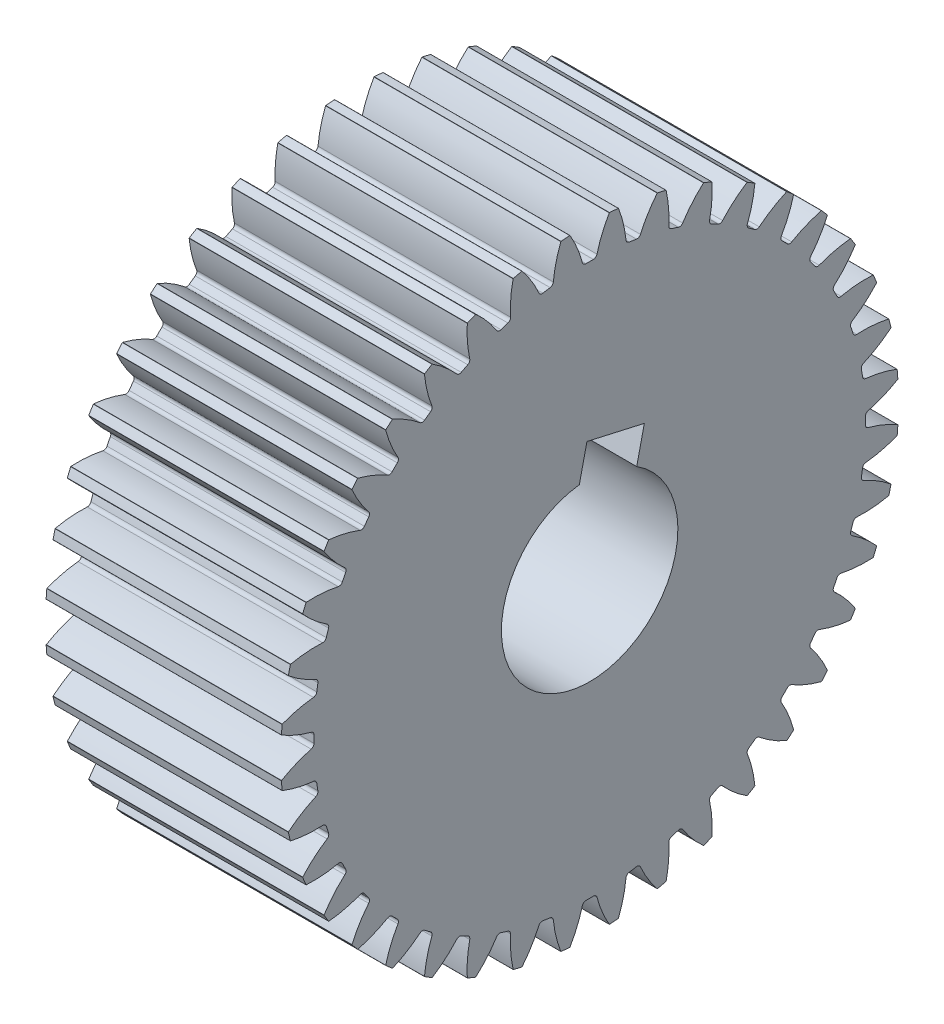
SolidWorks part; units mm, degrees
ref_plane "Plane1" through (0, 0, 0) normal (0, 0, 1) x (1, 0, 0)
ref_plane "Plane2" through (0, 0, 0) normal (0, 1, 0) x (1, 0, 0)
ref_plane "Plane3" through (0, 0, 0) normal (1, 0, 0) x (0, 0, -1)
sketch "HoldingSke" plane through (0, 0, 0) normal (0, 1, 0) x (1, 0, 0)
  line L0 (0, 0) -> (0.766, -0.6428)
  line L1 (-15, 0) -> (100, 0) construction
  line L2 (0, 0) -> (-2.1039, 2.3779)
  line L3 (0, 0) -> (-11.863, 4.5341)
  line L4 (0, 0) -> (6.6156, 5.5511)
  line L5 (0, 0) -> (-46.8476, -17.4728)
  line L6 (0, 0) -> (-13.2634, -8.9489)
  line L7 (-2.1039, 2.3779) -> (8.6586, 51.2059)
  line L8 (-76.2, 54.61) -> (-76.1, 54.61)
  line L9 (-71.009, 38.7566) -> (-53.1078, 45.2721)
  line L10 (-76.2, 71.12) -> (104.1128, 71.12)
  line L11 (0, 0) -> (-16, 0)
  line L12 (-76.2, 101.6) -> (-76.162, 101.6)
  line L13 (24.9733, 27.94) -> (52.9518, 28.4284)
  line L14 (24.9733, 27.94) -> (24.9743, 27.94)
  line L15 (24.9733, 27.94) -> (100.4006, 29.5858)
  line L16 (-63.627, -1) -> (-12.827, -1)
  circle A0 centre (0, 0) radius 0.4
  circle A1 centre (0, 0) radius 18.749
  circle A2 centre (0, 0) radius 37.5
  circle A3 centre (0, 0) radius 0.4
  dimension "MHD" = 37.498
  dimension "Hub_dia" = 75
  dimension "Bore" = 0.8
  dimension "MBD" = 0.8
  dimension "Num_teeth" = 40
  dimension "Pitch_radius" = 180.3128
  dimension "Pitch" = 1
  dimension "Width" = 16
  dimension "Overall_len" = 50
  dimension "Show_teeth" = 40
  dimension "Thickness" = 16
  dimension "OAL" = 50.0001
  dimension "T_dim" = 0.1
  dimension "Ap" = 20
  dimension "H" = 19.05
  dimension "Backlash" = 0.038
  dimension "Addendum_fac" = 1
  dimension "Dedendum_fac" = 1.25
  dimension "Clearance_fac" = 0.25
  dimension "Dedendum_add" = 0.001
  dimension "Module" = 1
sketch "BasProSke" plane through (0, 0, 0) normal (0, 1, 0) x (1, 0, 0)
  line L0 (-10, 0) -> (60, 0) construction
  line L1 (0, 0) -> (0, 21)
  line L2 (0, 0) -> (16, 0)
  line L3 (16, 0) -> (16, 21)
  line L4 (16, 21) -> (0, 21)
  dimension "Diameter" = 42
  dimension "Thickness" = 16
revolve "Base-Revolve" add sketch "BasProSke" angle 360 about L0
sketch "TooCutSke" plane through (0, 0, 0) normal (1, 0, 0) x (0, 0, -1)
  line L1 (0, 0) -> (0, 107) construction
  line L2 (0, 0) -> (-0.8517, 19.9819) construction
  line L3 (0, 0) -> (-3.1363, 39.8509) construction
  line L4 (-0.8517, 19.9819) -> (-1.5682, 19.9255) construction
  arc A0 (0.4487, 18.7436) -> (-0.4487, 18.7436) centre (0, 0) ccw
  arc A1 (1.3547, 20.9817) -> (-1.3547, 20.9817) centre (0, 0) ccw
  circle A2 centre (0, 0) radius 20 construction
  circle A3 centre (0, 0) radius 18.7939 construction
  arc A4 (-0.4487, 18.7436) -> (-1.3547, 20.9817) centre (-8.2322, 16.895) ccw
  arc A5 (1.3547, 20.9817) -> (0.4487, 18.7436) centre (8.2322, 16.895) ccw
  dimension "Root_dia" = 37.498
  dimension "Overcut_dia" = 42.0508
  dimension "Pitch_dia" = 40
  dimension "Base_dia" = 37.5877
  dimension "Flank_rad" = 8
  dimension "Half_ang" = 4.5
  dimension "Half_CT" = 0.7187
extrude "ToothCut" cut sketch "TooCutSke" along normal through all
fillet "Breaks" radius 0.02 2 edges at (8, 20.9572, -1.3402) (8, 20.9572, 1.3402)
fillet "RootFillets" radius 0.251 2 edges at (8, 18.7436, -0.4487) (8, 18.7436, 0.4487)
pattern_circular "TeethCuts" count 40 every 9 about axis through (-10, 0, 0) along (1, 0, 0) of "ToothCut", "RootFillets", "Breaks"
sketch "HubNeaOneSke" plane through (0, 0, 0) normal (-1, 0, 0) x (0, 0, 1)
  circle A0 centre (0, 0) radius 18.749
  dimension "Diameter" = 37.498
extrude "HubNearOne" [suppressed] add sketch "HubNeaOneSke" along normal blind 34.0001
sketch "HubNeaBotSke" plane through (0, 0, 0) normal (-1, 0, 0) x (0, 0, 1)
  circle A0 centre (0, 0) radius 18.749
  dimension "Diameter" = 37.498
extrude "HubNearBoth" [suppressed] add sketch "HubNeaBotSke" along normal blind 17
ref_plane "FarPln" through (16, 0, 0) normal (1, 0, 0) x (0, 0, -1)
sketch "HubFarSke" plane through (16, 0, 0) normal (1, 0, 0) x (0, 0, -1)
  circle A0 centre (0, 0) radius 18.749
  dimension "Diameter" = 37.498
extrude "HubFar" [suppressed] add sketch "HubFarSke" along normal blind 17
sketch "BorSke" plane through (0, 0, 0) normal (1, 0, 0) x (0, 0, -1)
  circle A0 centre (0, 0) radius 0.4
  dimension "Diameter" = 0.8
extrude "Bore" cut sketch "BorSke" along normal mid plane 100.0001
sketch "KeySke" plane through (0, 0, 0) normal (1, 0, 0) x (0, 0, -1)
  line L0 (-0.05, 0) -> (-0.05, 0.5)
  line L1 (-0.05, 0.5) -> (0.05, 0.5)
  line L2 (0.05, 0.5) -> (0.05, 0)
  line L3 (0, 0) -> (0, 34) construction
  line L4 (-0.05, 0) -> (0.05, 0)
  dimension "Offset" = 0.5
  dimension "Width" = 0.1
extrude "Keyway" [suppressed] cut sketch "KeySke" along normal mid plane 100.0001
pattern_circular "Keyway2" [suppressed] count 2 every 90 about axis through (-10, 0, 0) along (1, 0, 0)
sketch "草图1" plane through (0, 0, 0) normal (-1, 0, 0) x (0, 0, 1)
  line L0 (-3.7172, 7.3609) -> (-3.1998, 5.0756)
  line L1 (-3.7172, 7.3609) -> (0.1841, 8.2442)
  line L2 (0.1841, 8.2442) -> (0.7015, 5.9589)
  arc A0 (-3.1998, 5.0756) -> (0.7015, 5.9589) centre (0, 0) ccw
  dimension "D1" = 0.205
  dimension "D2" = 0.3124
extrude "切除-拉伸1" cut sketch "草图1" against normal through all
equation "' \"Module@HoldingSke\" = 6.35"
equation "' \"Num_teeth@HoldingSke\" = 12"
equation "' \"Ap@HoldingSke\" =  20"
equation "' \"Width@HoldingSke\" = 0.5 * 25.4"
equation "' \"Hub_dia@HoldingSke\"= 1 * 25.4"
equation "' \"Overall_len@HoldingSke\" = 1.0 * 25.4"
equation "' \"Bore@HoldingSke\" = 0.75 * 25.4"
equation "' \"T_dim@HoldingSke\" = 0.1 * 25.4"
equation "' \"Width@KeySke\" = 0.25 * 25.4"
equation "' \"Show_teeth@HoldingSke\" = 13"
equation "' \"Backlash@HoldingSke\" = 0.009 * 25.4"
equation "' \"Addendum_fac@HoldingSke\" = 1.0"
equation "' \"Dedendum_fac@HoldingSke\" = 1.25"
equation "' \"Dedendum_add@HoldingSke\" = 0.00005 * 25.4"
equation "' \"Clearance_fac@HoldingSke\" = 0.25"
equation "\"Pitch@HoldingSke\" = 1 / \"Module@HoldingSke\""
equation "\"Overcut_dia@TooCutSke\" = (\"Num_teeth@HoldingSke\" + 2 * \"Addendum_fac@HoldingSke\") / \"Pitch@HoldingSke\" + 0.002 * 25.4"
equation "\"Pitch_dia@TooCutSke\" = \"Num_teeth@HoldingSke\" / \"Pitch@HoldingSke\""
equation "\"Base_dia@TooCutSke\" = \"Num_teeth@HoldingSke\" / \"Pitch@HoldingSke\" * cos((\"Ap@HoldingSke\"  * 3.14159265 / 180))"
equation "\"Root_dia@TooCutSke\" = (\"Num_teeth@HoldingSke\" + 2) / \"Pitch@HoldingSke\" - 2 * (\"Addendum_fac@HoldingSke\" + \"Dedendum_fac@HoldingSke\") / \"Pitch@HoldingSke\" - \"Dedendum_add@HoldingSke\" * 2"
equation "\"Half_ang@TooCutSke\" = 180 / \"Num_teeth@HoldingSke\""
equation "\"Half_CT@TooCutSke\" = \"Num_teeth@HoldingSke\" / \"Pitch@HoldingSke\" * sin((3.14159265 / 2 / \"Num_teeth@HoldingSke\")) / 2 - 7 * \"Backlash@HoldingSke\" / 4"
equation "\"Flank_rad@TooCutSke\" = \"Num_teeth@HoldingSke\" / \"Pitch@HoldingSke\" / 5"
equation "\"Radius@RootFillets\" = \"Clearance_fac@HoldingSke\" / \"Pitch@HoldingSke\" + \"Dedendum_add@HoldingSke\""
equation "\"Break_rad@Breaks\" = 0.02 / \"Pitch@HoldingSke\""
equation "\"Thickness@HoldingSke\" = \"Width@HoldingSke\""
equation "\"OAL@HoldingSke\" = \"Thickness@HoldingSke\""
equation "\"MHD@HoldingSke\" = (\"Num_teeth@HoldingSke\" + 2) / \"Pitch@HoldingSke\" - 2 * (\"Addendum_fac@HoldingSke\" + \"Dedendum_fac@HoldingSke\")  / \"Pitch@HoldingSke\" - \"Dedendum_add@HoldingSke\" * 2"
equation "\"MBD@HoldingSke\" = (\"Num_teeth@HoldingSke\" + 2) / \"Pitch@HoldingSke\" - 2 * (\"Addendum_fac@HoldingSke\" + \"Dedendum_fac@HoldingSke\")  / \"Pitch@HoldingSke\" - \"Dedendum_add@HoldingSke\" * 2 - 0.002 * 25.4"
equation "\"MHD@HoldingSke\" = ((sgn( \"MHD@HoldingSke\" - \"Hub_dia@HoldingSke\" )-1)*( \"MHD@HoldingSke\" - \"Hub_dia@HoldingSke\" ))/-2+ \"Hub_dia@HoldingSke\""
equation "\"MBD@HoldingSke\" = ((sgn( \"MBD@HoldingSke\" - \"Bore@HoldingSke\" )-1)*( \"MBD@HoldingSke\" - \"Bore@HoldingSke\" ))/-2+ \"Bore@HoldingSke\""
equation "\"OAL@HoldingSke\" = ((sgn( \"OAL@HoldingSke\" - \"Overall_len@HoldingSke\" )+1)*( \"OAL@HoldingSke\" - \"Overall_len@HoldingSke\" ))/2 + \"Overall_len@HoldingSke\" + 0.000002 * 25.4"
equation "\"Num_teeth@TeethCuts\" = int( \"Show_teeth@HoldingSke\" ) + 1"
equation "\"Num_teeth@TeethCuts\" = ((sgn( \"Num_teeth@TeethCuts\" - \"Num_teeth@HoldingSke\" )-1)*( \"Num_teeth@TeethCuts\" - \"Num_teeth@HoldingSke\" ))/-2+ \"Num_teeth@HoldingSke\""
equation "\"Num_teeth@TeethCuts\" = ((sgn( \"Num_teeth@TeethCuts\" - 2.0)+1)*( \"Num_teeth@TeethCuts\" - 2.0))/2 +2.0"
equation "\"Angle@TeethCuts\" = 360.0 / \"Num_teeth@HoldingSke\""
equation "\"Diameter@BasProSke\" = (\"Num_teeth@HoldingSke\" + 2 * \"Addendum_fac@HoldingSke\") / \"Pitch@HoldingSke\""
equation "\"Thickness@BasProSke\"  = \"Thickness@HoldingSke\""
equation "' \"Fillet_rad@BasProSke\" =  \"Thickness@HoldingSke\" * 0.05"
equation "\"MHD@HoldingSke\" = ((sgn( \"MHD@HoldingSke\" - \"Root_dia@TooCutSke\" )-1)*( \"MHD@HoldingSke\" - \"Root_dia@TooCutSke\" ))/-2+ \"Root_dia@TooCutSke\""
equation "\"Diameter@HubNeaOneSke\" = \"MHD@HoldingSke\""
equation "\"Length@HubNearOne\" = \"OAL@HoldingSke\" - \"Thickness@BasProSke\""
equation "\"Diameter@HubNeaBotSke\" = \"MHD@HoldingSke\""
equation "\"Length@HubNearBoth\" = ( \"OAL@HoldingSke\" - \"Thickness@BasProSke\" ) / 2.0"
equation "\"Thickness@FarPln\" = \"Thickness@BasProSke\""
equation "\"Diameter@HubFarSke\" = \"MHD@HoldingSke\""
equation "\"Length@HubFar\" = ( \"OAL@HoldingSke\" - \"Thickness@BasProSke\" ) / 2.0"
equation "\"Diameter@BorSke\" = \"MBD@HoldingSke\""
equation "\"D1@Bore\" = \"OAL@HoldingSke\" * 2.0"
equation "\"D1@Keyway\" = \"OAL@HoldingSke\" * 2.0"
equation "\"Offset@KeySke\" = \"T_dim@HoldingSke\" + \"MBD@HoldingSke\" / 2.0"
